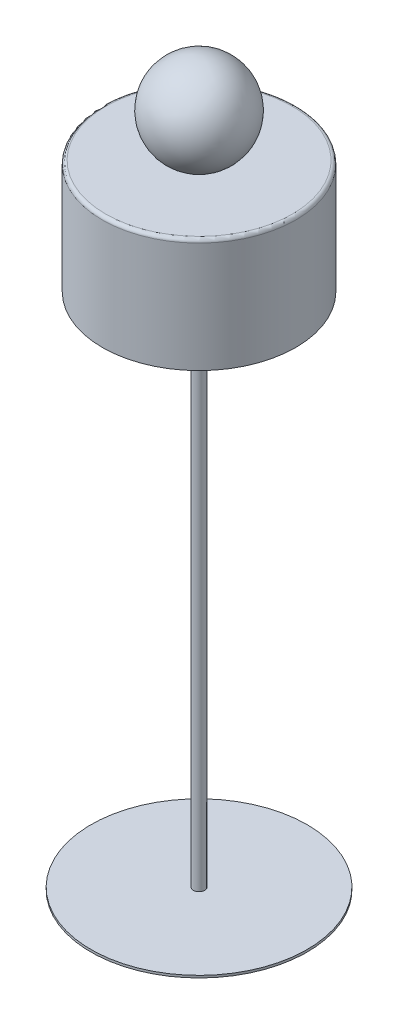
SolidWorks part; units mm, degrees
ref_plane "Alzado" through (0, 0, 0) normal (0, 0, 1) x (1, 0, 0)
ref_plane "Planta" through (0, 0, 0) normal (0, 1, 0) x (1, 0, 0)
ref_plane "Vista lateral" through (0, 0, 0) normal (1, 0, 0) x (0, 0, -1)
sketch "Croquis1" plane through (0, 0, 0) normal (0, 1, 0) x (1, 0, 0)
  circle A0 centre (0, 0) radius 85
extrude "Saliente-Extruir1" add sketch "Croquis1" along normal blind 100
fillet "Redondeo1" radius 3 1 edges at (0, 100, 85)
shell "Vaciado1" thickness 3
sketch "Croquis2" plane through (0, 0, 0) normal (0, 0, 1) x (1, 0, 0)
  line L0 (0, 97.9605) -> (0, 137.9605)
  line L2 (0, 137.9605) -> (-40, 137.9605)
  arc A0 (-40, 137.9605) -> (0, 97.9605) centre (0, 137.9605) ccw
revolve "Revolución1" add sketch "Croquis2" angle 360 about L2
mirror "Simetría4" about plane through (0, 0, 0) normal (1, 0, 0)
sketch "Croquis3" plane through (0, 97, 0) normal (0, -1, 0) x (1, 0, 0)
  circle A0 centre (0, 0) radius 34.8727
extrude "Saliente-Extruir2" add sketch "Croquis3" along normal blind 50 separate body
sketch "Croquis4" plane through (0, 47, 0) normal (0, -1, 0) x (1, 0, 0)
  circle A0 centre (0, 0) radius 5
extrude "Saliente-Extruir3" add sketch "Croquis4" along normal blind 500 separate body
sketch "Croquis5" plane through (0, -453, 0) normal (0, -1, 0) x (1, 0, 0)
  circle A0 centre (0, 0) radius 95
extrude "Saliente-Extruir4" add sketch "Croquis5" along normal blind 2 separate body
